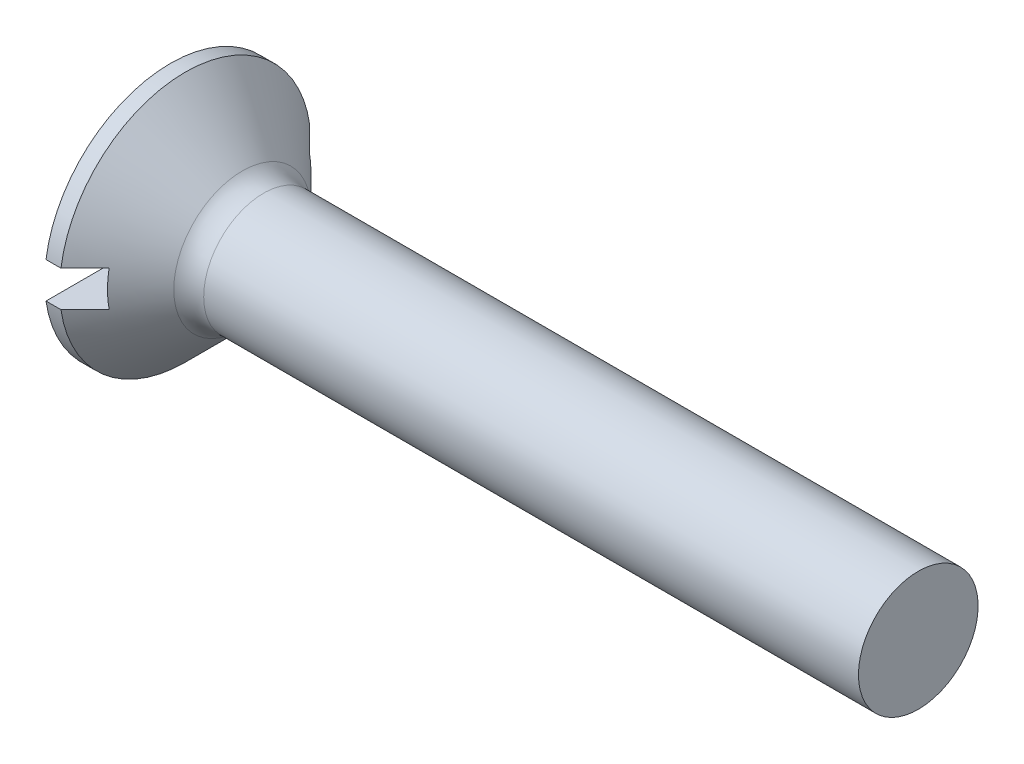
SolidWorks part; units mm, degrees
revolve "Base-Revolve" add sketch "BodySke" angle 360 about L5
sketch "BodySke" plane through (0, 0, 0) normal (0, 0, 1) x (1, 0, 0)
  line L0 (0, 0) -> (0, 4.2)
  line L1 (0, 4.2) -> (0.5, 4.2)
  line L2 (2.7, 2) -> (25, 2)
  line L3 (25, 2) -> (25, 0)
  line L4 (25, 0) -> (0, 0)
  line L5 (-6.35, 0) -> (82.55, 0) construction
  line L6 (2.7, -2) -> (25, -2) construction
  line L7 (0.5, -4.2) -> (2.7, -2) construction
  line L8 (0.5, 4.2) -> (2.7, 2)
  line L9 (0, -4.2) -> (0.5, -4.2) construction
  line L10 (3.4, 3.5875) -> (3.4, -5.9375) construction
  line L11 (0, 6.35) -> (0, -3.175) construction
extrude "Slot" cut sketch "Sketch2" against normal blind 1.3
sketch "Sketch2" plane through (0, 0, 0) normal (-1, 0, 0) x (0, 0, 1)
  line L0 (-4.2, -0.6) -> (4.2, -0.6)
  line L1 (-4.2, -0.6) -> (-4.2, 0.6)
  line L2 (4.2, 0.6) -> (-4.2, 0.6)
  line L3 (4.2, 0.6) -> (4.2, -0.6)
ref_plane "Plane1" through (0, 0, 0) normal (0, 0, 1) x (1, 0, 0)
ref_plane "Plane2" through (0, 0, 0) normal (0, 1, 0) x (1, 0, 0)
ref_plane "Plane3" through (0, 0, 0) normal (1, 0, 0) x (0, 0, -1)
fillet "Fillet1" radius 1 1 edges at (2.7, 0, 2)
sketch "ThdSchSke" plane through (0, 0, 0) normal (0, 0, 1) x (1, 0, 0)
  line L0 (3.4, -1.61) -> (3.1269, -2)
  line L1 (3.4, -1.61) -> (3.6731, -2)
  line L2 (3.6731, -2) -> (3.6731, -2.5)
  line L3 (-3.175, 0) -> (5.1513, 0) construction
  line L5 (3.6731, -2.5) -> (3.1269, -2.5)
  line L6 (3.1269, -2.5) -> (3.1269, -2)
  line L7 (0, 4.2) -> (0, 0.6) construction
revolve "ThreadSchematic" [suppressed] cut sketch "ThdSchSke" angle 360 about L3
pattern_linear "ThdSchPat" [suppressed]
equation "\"D1@Sketch2\" = \"Slot_width@Sketch2\" / 2"
equation "\"D2@Sketch2\" = \"Head_dia@BodySke\""
equation "\"D3@Sketch2\" = \"D2@Sketch2\" / 2"
equation "\"Thread_length@ThreadCosmetic\" = ((sgn( (\"Length@BodySke\" - \"Advance@BodySke\" * 1.0 - \"Head_ht@BodySke\" ) - \"Thread_nom@BodySke\" )-1)*( (\"Length@BodySke\" - \"Advance@BodySke\" * 1.0 - \"Head_ht@BodySke\" "
equation "\"Thread_minor@ThdSchSke\" = \"Thread_minor@ThreadCosmetic\""
equation "\"Diameter@ThdSchSke\" = \"Diameter@BodySke\""
equation "\"Overcut@ThdSchSke\" = \"Diameter@BodySke\" * 1.25"
equation "\"Start@ThdSchSke\" = 0.000001 + \"Length@BodySke\" - \"Thread_length@ThreadCosmetic\"  '---Countersunk---"
equation "\"Num_threads@ThdSchPat\" = int( \"Thread_length@ThreadCosmetic\" / \"Advance@BodySke\" + 0.999 )  + 1"
equation "\"Advance@ThdSchPat\" = \"Thread_length@ThreadCosmetic\" /  (\"Num_threads@ThdSchPat\" - 1) 'relax it"
